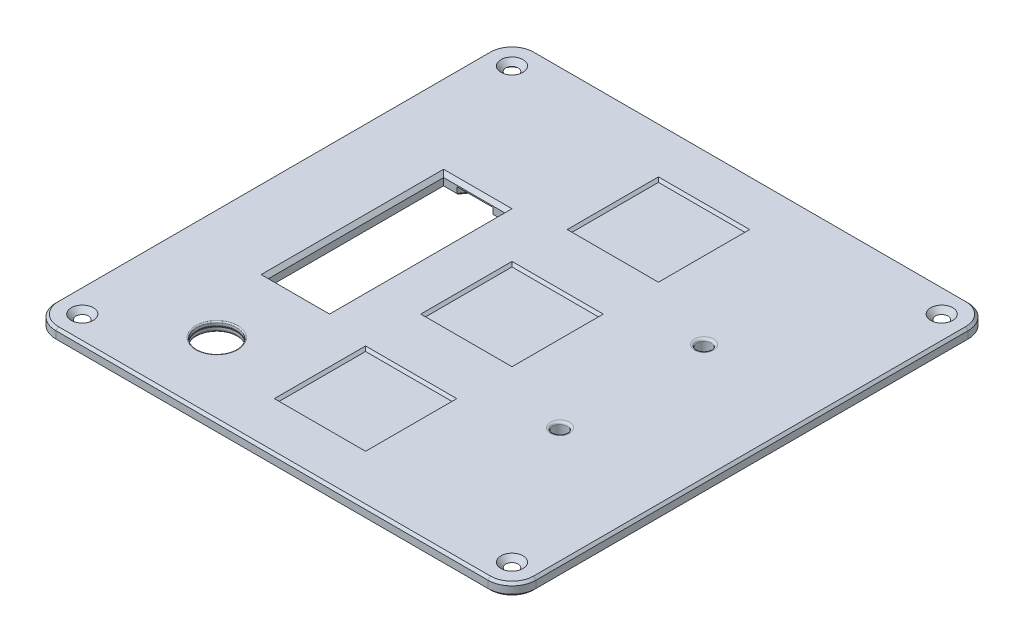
SolidWorks part; units mm, degrees
ref_plane "Front Plane" through (0, 0, 0) normal (0, 0, 1) x (1, 0, 0)
ref_plane "Top Plane" through (0, 0, 0) normal (0, 1, 0) x (1, 0, 0)
ref_plane "Right Plane" through (0, 0, 0) normal (1, 0, 0) x (0, 0, -1)
sketch "Sketch1" plane through (0, 0, 0) normal (0, 1, 0) x (1, 0, 0)
  line L5 (100, -100) -> (-100, -100)
  line L6 (100, -100) -> (100, 100)
  line L7 (100, 100) -> (-100, 100)
  line L8 (-100, -100) -> (-100, 100)
  line L9 (100, -100) -> (-100, 100) construction
  line L10 (100, 100) -> (-100, -100) construction
  point P0 (0, 0)
  dimension "D1" = 200
  dimension "D2" = 200
extrude "Grundplatte" add sketch "Sketch1" along normal blind 5
sketch "Sketch2" plane through (0, 5, 0) normal (0, 1, 0) x (1, 0, 0)
  line L0 (-100, -30.5) -> (100, -30.5) construction
  line L9 (-100, 100) -> (-100, -100) construction
  line L10 (100, -100) -> (100, 100) construction
  line L11 (-100, 30.5) -> (100, 30.5) construction
  line L20 (-18, 79) -> (18, 79)
  line L25 (-18, -18) -> (18, -18)
  line L26 (-18, -18) -> (-18, 18)
  line L27 (-18, 18) -> (18, 18)
  line L28 (18, -18) -> (18, 18)
  line L29 (-18, -18) -> (18, 18) construction
  line L30 (-18, 18) -> (18, -18) construction
  line L31 (18, 79) -> (18, 43)
  line L32 (-18, 79) -> (-18, 43)
  line L33 (-18, 43) -> (18, 43)
  line L34 (18, -43) -> (18, -79)
  line L35 (-18, -43) -> (18, -43)
  line L36 (-18, -43) -> (-18, -79)
  line L37 (-18, -79) -> (18, -79)
  point P0 (0, 0)
  dimension "D1" = 36
  dimension "D2" = 36
  dimension "D3" = 25
  dimension "D4" = 25
extrude "Magnet Box" cut sketch "Sketch2" against normal blind 1
sketch "Sketch3" plane through (0, 5, 0) normal (0, 1, 0) x (1, 0, 0)
  line L1 (-39.5, -36.5) -> (-65, -36.5)
  line L2 (-39.5, -36.5) -> (-39.5, 36.5)
  line L3 (-39.5, 36.5) -> (-65, 36.5)
  line L4 (-65, -36.5) -> (-65, 36.5)
  line L5 (-39.5, -36.5) -> (-65, 36.5) construction
  line L6 (-39.5, 36.5) -> (-65, -36.5) construction
  line L7 (-100, 100) -> (-100, -100) construction
  line L8 (100, 100) -> (-100, 100) construction
  point P0 (-52.25, 0)
  dimension "D1" = 73
  dimension "D2" = 25.5
  dimension "D3" = 100
  dimension "D4" = 35
extrude "LCD" cut sketch "Sketch3" against normal blind 7
sketch "Sketch8" plane through (0, 5, 0) normal (0, 1, 0) x (1, 0, 0)
  line L0 (-100, -100) -> (100, -100) construction
  line L1 (100, -100) -> (100, 100) construction
  circle A0 centre (-53, -70) radius 8.25
  dimension "D1" = 16.5
  dimension "D2" = 30
  dimension "D3" = 153
extrude "Reset Taster" cut sketch "Sketch8" against normal blind 10
sketch "Sketch10" plane through (0, 0, 0) normal (0, -1, 0) x (1, 0, 0)
  line L1 (97, -97) -> (-97, -97)
  line L2 (97, -97) -> (97, 97)
  line L3 (97, 97) -> (-97, 97)
  line L4 (-97, -97) -> (-97, 97)
  line L5 (97, -97) -> (-97, 97) construction
  line L6 (97, 97) -> (-97, -97) construction
  point P0 (0, 0)
  dimension "D1" = 194
  dimension "D2" = 194
extrude "Hinter Außenkanten" cut sketch "Sketch10" against normal blind 3
sketch "Sketch13" plane through (0, 5, 0) normal (0, 1, 0) x (1, 0, 0)
  line L0 (100, 100) -> (-100, 100) construction
  line L1 (-100, 100) -> (-100, -100) construction
  line L2 (100, -100) -> (100, 100) construction
  line L3 (-100, -100) -> (100, -100) construction
  point P0 (-89.5, 89.5)
  point P2 (89.5, 89.5)
  point P4 (89.5, -89.5)
  point P6 (-89.5, -89.5)
  dimension "D1" = 10.5
  dimension "D2" = 10.5
  dimension "D3" = 10.5
  dimension "D5" = 10.5
  dimension "D6" = 10.5
  dimension "D7" = 10.5
  dimension "D8" = 10.5
  dimension "D9" = 10.5
hole_wizard "CSK for M4 Hex Socket Countersunk Head Screw1" positions "Sketch13" profile "Sketch14" countersink size "M4" standard "DIN"
sketch "Sketch14" plane through (-89.5, 5, -89.5) normal (1, 0, 0) x (0, 0, 1)
  line L0 (0, 0) -> (0, 5)
  line L1 (0, 5) -> (2.25, 5)
  line L2 (2.25, 5) -> (2.25, 2.34)
  line L3 (2.25, 2.34) -> (4.59, 0)
  line L5 (4.59, 0) -> (0, 0)
  line L6 (-2.25, 2.34) -> (-4.59, 0) construction
  line L11 (0, -6.35) -> (0, 107.95) construction
  dimension "Thru Hole Dia." = 4.5
  dimension "Thru Hole Depth" = 5
  dimension "Near C'Sink Dia." = 9.18
  dimension "Near C'Sink Angle" = 90
fillet "Taster" radius 0.5 2 edges at (-53, 3, 61.75) (-53, 5, 78.25)
chamfer "Magnet Kasten" distance 1 angle 45 12 edges at (0, 5, -43) (-18, 5, -61) (0, 5, -79) (18, 5, -61) (18, 5, 0) (0, 5, -18) (0, 5, 18) (-18, 5, 0) (0, 5, 43) (18, 5, 61) (0, 5, 79) (-18, 5, 61)
sketch "Sketch16" plane through (0, 3, 0) normal (0, -1, 0) x (1, 0, 0)
  line L0 (-39.5, 36.5) -> (-65, 36.5)
  line L1 (-65, 36.5) -> (-65, -36.5)
  line L2 (-65, -36.5) -> (-39.5, -36.5)
  line L3 (-39.5, -36.5) -> (-39.5, 36.5)
  line L4 (-31.5, 44.5) -> (-74, 44.5)
  line L5 (-74, 44.5) -> (-74, -43.8223)
  line L6 (-74, -43.8223) -> (-56.3223, -61.5)
  line L7 (-56.3223, -61.5) -> (-31.5, -36.6777)
  line L8 (-31.5, 44.5) -> (-31.5, -36.6777)
  dimension "D1" = 8
  dimension "D2" = 9
  dimension "D3" = 8
  dimension "D4" = 45
  dimension "D5" = 45
  dimension "D6" = 25
  dimension "D7" = 25
extrude "LCD Halter" add sketch "Sketch16" along normal blind 3.5
sketch "Sketch17" plane through (0, -0.5, 0) normal (0, -1, 0) x (1, 0, 0)
  line L0 (-59.5, -36.5) -> (-44.5, -36.5)
  line L1 (-65, -36.5) -> (-39.5, -36.5) construction
  line L2 (-44.5, -36.5) -> (-47.5, -40.7)
  line L3 (-47.5, -40.7) -> (-56.5, -40.7)
  line L4 (-56.5, -40.7) -> (-59.5, -36.5)
  line L5 (-39.5, 36.5) -> (-39.5, -36.5) construction
  dimension "D1" = 9
  dimension "D2" = 5
  dimension "D3" = 8
  dimension "D4" = 4.2
extrude "Cut-Extrude2" cut sketch "Sketch17" against normal blind 3.5
chamfer "Chamfer3" distance 1.5 angle 45 4 edges at (-39.5, 5, 0) (-52.25, 5, -36.5) (-52.25, 5, 36.5) (-65, 5, 0)
chamfer "Chamfer4" distance 1 angle 45 13 edges at (-52.25, -0.5, 36.5) (-65, -0.5, 0) (-62.25, -0.5, -36.5) (-39.5, -0.5, 0) (-42, -0.5, -36.5) (-46, -0.5, -38.6) (-52, -0.5, -40.7) (-58, -0.5, -38.6) (-52.75, -0.5, 44.5) (-74, -0.5, 0.3388) (-65.1612, -0.5, -52.6612) (-43.9112, -0.5, -49.0888) (-31.5, -0.5, 3.9112)
fillet "Fillet1" radius 1 5 edges at (-31.5, 1.75, 44.5) (-74, 1.75, 44.5) (-74, 1.75, -43.8223) (-31.5, 1.75, -36.6777) (-56.3223, 1.75, -61.5)
sketch "Sketch18" plane through (0, 3, 0) normal (0, -1, 0) x (1, 0, 0)
  circle A0 centre (-53, 70) radius 15
  dimension "D1" = 30
extrude "Taster Halter" add sketch "Sketch18" along normal blind 2
sketch "Sketch22" plane through (0, 1, 0) normal (0, -1, 0) x (1, 0, 0)
  circle A0 centre (-53, 70) radius 8.25
  dimension "D1" = 16.5
extrude "Cut-Extrude3" cut sketch "Sketch22" against normal blind 3
fillet "Fillet2" radius 1 2 edges at (-53, 1, 55) (-53, 1, 61.75)
fillet "Fillet3" radius 10 4 edges at (100, 2.5, -100) (-100, 2.5, -100) (-100, 2.5, 100) (100, 2.5, 100)
chamfer "Chamfer5" distance 1 angle 45 16 edges at (-97.0711, 0, -97.0711) (0, 0, -100) (-100, 0, 0) (97.0711, 0, -97.0711) (-97.0711, 0, 97.0711) (100, 0, 0) (0, 0, 100) (97.0711, 0, 97.0711) (-100, 5, 0) (-97.0711, 5, 97.0711) (-97.0711, 5, -97.0711) (0, 5, 100) (0, 5, -100) (97.0711, 5, 97.0711) (97.0711, 5, -97.0711) (100, 5, 0)
fillet "Fillet4" radius 10 4 edges at (97, 1.9497, -97) (97, 1.9497, 97) (-97, 1.9497, 97) (-97, 1.9497, -97)
sketch "Sketch25" plane through (0, 4, 0) normal (0, 1, 0) x (1, 0, 0)
  line L0 (1.5, 2.7) -> (-4, 2.7)
  line L1 (-4, 2.7) -> (-4, -2.8)
  line L2 (-4, -2.8) -> (1.5, -2.8)
  line L3 (18, -18) -> (18, 18) construction
  line L4 (18, 18) -> (-18, 18) construction
  line L5 (1.5, 2.7) -> (1.5, 2.2)
  line L6 (1.5, 2.2) -> (-3.5, 2.2)
  line L7 (-3.5, 2.2) -> (-3.5, -2.3)
  line L8 (-3.5, -2.3) -> (1.5, -2.3)
  line L9 (1.5, -2.3) -> (1.5, -2.8)
  dimension "D1" = 5.5
  dimension "D2" = 5.5
  dimension "D3" = 5.5
  dimension "D4" = 16.5
  dimension "D5" = 15.3
  dimension "D6" = 5
  dimension "D7" = 0.5
  dimension "D8" = 0.5
extrude "Sensor Halter" add sketch "Sketch25" against normal blind 2.65
sketch "Sketch26" plane through (0, 1.35, 0) normal (0, -1, 0) x (1, 0, 0)
  line L1 (-4, -2.7) -> (1.5, -2.7)
  line L2 (-4, -2.7) -> (-4, 2.8)
  line L3 (-4, 2.8) -> (1.5, 2.8)
  line L4 (1.5, -2.7) -> (1.5, 2.8)
extrude "Sensor_Halter" add sketch "Sketch26" along normal blind 1
sketch "Sketch27" plane through (0, 4, 0) normal (0, 1, 0) x (1, 0, 0)
  line L0 (1.5, 62.7) -> (-4, 62.7)
  line L1 (-4, 62.7) -> (-4, 57.4)
  line L2 (-4, 57.4) -> (1.5, 57.4)
  line L3 (1.5, 57.4) -> (1.5, 57.9)
  line L4 (1.5, 57.9) -> (-3.5, 57.9)
  line L5 (-3.5, 57.9) -> (-3.5, 62.2)
  line L6 (-3.5, 62.2) -> (1.5, 62.2)
  line L7 (1.5, 62.2) -> (1.5, 62.7)
  line L8 (18, 79) -> (-18, 79) construction
  line L9 (18, 43) -> (18, 79) construction
  line L10 (-18, 0) -> (18, 0) construction
  line L11 (-18, 18) -> (-18, -18) construction
  line L12 (18, -18) -> (18, 18) construction
  line L13 (1.5, -57.9) -> (-3.5, -57.9)
  line L14 (-4, -57.4) -> (1.5, -57.4)
  line L15 (1.5, -57.4) -> (1.5, -57.9)
  line L16 (1.5, -62.2) -> (1.5, -62.7)
  line L17 (1.5, -62.7) -> (-4, -62.7)
  line L18 (-3.5, -62.2) -> (1.5, -62.2)
  line L19 (-3.5, -57.9) -> (-3.5, -62.2)
  line L20 (-4, -62.7) -> (-4, -57.4)
  line L22 (-4, -62.7) -> (1.5, -62.7)
  line L23 (-4, -62.7) -> (-4, -57.4)
  line L24 (-4, -57.4) -> (1.5, -57.4)
  line L25 (1.5, -62.7) -> (1.5, -57.4)
  dimension "D1" = 5.5
  dimension "D2" = 5.5
  dimension "D3" = 5.3
  dimension "D4" = 0.5
  dimension "D5" = 0.5
  dimension "D6" = 0.5
  dimension "D7" = 16.3
  dimension "D8" = 16.5
  dimension "D9" = 5.5
  dimension "D10" = 5.3
extrude "Sensor Halter 2 und 3" add sketch "Sketch27" against normal blind 2.65 contours L6 L7 L0 L1 L2 L3 L4 L5 | L20 L17 L16 L18 L19 L13 L15 L14
sketch "Sketch28" plane through (0, 1.35, 0) normal (0, -1, 0) x (1, 0, 0)
  line L1 (-4, 57.4) -> (1.5, 57.4)
  line L2 (-4, 57.4) -> (-4, 62.7)
  line L3 (-4, 62.7) -> (1.5, 62.7)
  line L4 (1.5, 57.4) -> (1.5, 62.7)
extrude "Sensor_Halter_02" add sketch "Sketch28" along normal blind 1
sketch "Sketch29" plane through (0, 1.35, 0) normal (0, -1, 0) x (1, 0, 0)
  line L1 (-4, -62.7) -> (1.5, -62.7)
  line L2 (-4, -62.7) -> (-4, -57.4)
  line L3 (-4, -57.4) -> (1.5, -57.4)
  line L4 (1.5, -62.7) -> (1.5, -57.4)
extrude "Sensor_Halter_03" add sketch "Sketch29" along normal blind 1
fillet "Sensor_Halter Verrundung" radius 0.5 27 edges at (-4, 1.675, -57.4) (-4, 1.675, -62.7) (-4, 3, -60.05) (1.5, 1.675, -62.7) (-1.25, 3, -62.7) (-1.25, 3, -57.4) (1.5, 1.675, -57.4) (-1.25, 3, 57.4) (-4, 3, 60.05) (1.5, 1.675, 57.4) (-4, 1.675, 57.4) (-4, 1.675, 62.7) (-1.25, 3, 62.7) (1.5, 1.675, 62.7) (-4, 3, 0.05) (-4, 1.675, 2.8) (1.5, 1.675, 2.8) (-1.25, 3, 2.8) (-4, 1.675, -2.7) (-1.25, 3, -2.7) (1.5, 1.675, -2.7) (-3.5, 2.175, 62.2) (-3.5, 2.175, 57.9) (-3.5, 2.175, 2.3) (-3.5, 2.175, -2.2) (-3.5, 2.175, -57.9) (-3.5, 2.175, -62.2)
chamfer "Sensor_Halter Fase" distance 0.3 angle 45 24 edges at (-4, 0.35, 60.05) (-3.8536, 0.35, 57.5464) (-3.8536, 0.35, 62.5536) (-1.25, 0.35, 57.4) (-1.25, 0.35, 62.7) (1.3536, 0.35, 57.5464) (1.3536, 0.35, 62.5536) (1.5, 0.35, 60.05) (-4, 0.35, 0.05) (-3.8536, 0.35, -2.5536) (-3.8536, 0.35, 2.6536) (-1.25, 0.35, -2.7) (-1.25, 0.35, 2.8) (1.3536, 0.35, -2.5536) (1.3536, 0.35, 2.6536) (1.5, 0.35, 0.05) (-1.25, 0.35, -62.7) (1.3536, 0.35, -62.5536) (-3.8536, 0.35, -62.5536) (1.5, 0.35, -60.05) (-4, 0.35, -60.05) (1.3536, 0.35, -57.5464) (-3.8536, 0.35, -57.5464) (-1.25, 0.35, -57.4)
sketch "Sketch30" plane through (0, 5, 0) normal (0, 1, 0) x (1, 0, 0)
  line L0 (90, 99) -> (-90, 99) construction
  line L1 (-99, 90) -> (-99, -90) construction
  circle A0 centre (51, 29) radius 3
  circle A1 centre (51, -31) radius 3
  dimension "D1" = 6
  dimension "D4" = 6
  dimension "D2" = 70
  dimension "D3" = 150
  dimension "D5" = 130
  dimension "D6" = 150
extrude "LEDs" cut sketch "Sketch30" against normal blind 5
sketch "Sketch31" plane through (0, 3, 0) normal (0, -1, 0) x (1, 0, 0)
  circle A0 centre (51, -29) radius 4
  circle A1 centre (51, 31) radius 4
  dimension "D1" = 8
  dimension "D2" = 8
extrude "LEDS_unterstützung" add sketch "Sketch31" along normal blind 5
sketch "Sketch34" plane through (0, 3, 0) normal (0, 1, 0) x (1, 0, 0)
  circle A0 centre (51, 29) radius 3
  circle A1 centre (51, -31) radius 3
  dimension "D1" = 6
  dimension "D2" = 6
extrude "Cut-Extrude6" cut sketch "Sketch34" against normal blind 3
sketch "Sketch36" plane through (0, 0, 0) normal (0, 1, 0) x (1, 0, 0)
  circle A0 centre (51, 29) radius 2
  dimension "D1" = 4
extrude "Cut-Extrude7" cut sketch "Sketch36" against normal blind 3
sketch "Sketch38" plane through (0, 0, 0) normal (0, 1, 0) x (1, 0, 0)
  circle A0 centre (51, -31) radius 2
  dimension "D1" = 4
extrude "Cut-Extrude8" cut sketch "Sketch38" against normal blind 3
fillet "Verrundung_LCD_Halter" radius 1 2 edges at (51, 5, 34) (51, 5, -26)
